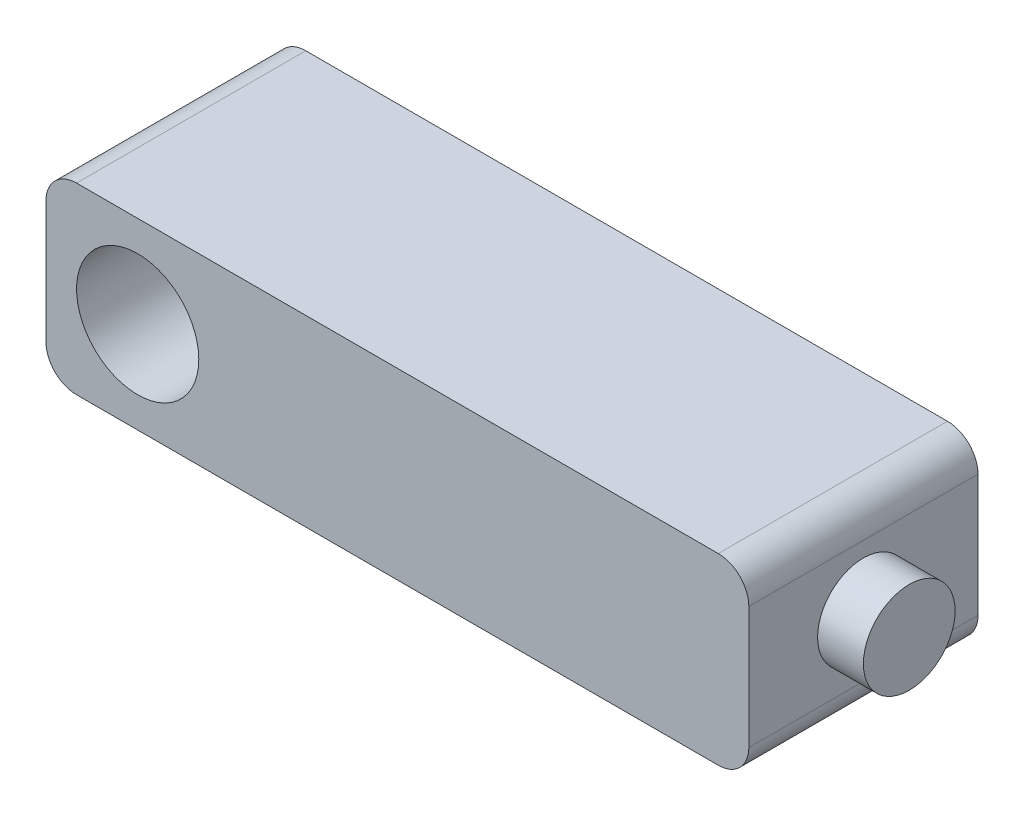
SolidWorks part; units mm, degrees
ref_plane "正面" through (0, 0, 0) normal (0, 0, 1) x (1, 0, 0)
ref_plane "平面" through (0, 0, 0) normal (0, 1, 0) x (1, 0, 0)
ref_plane "右側面" through (0, 0, 0) normal (1, 0, 0) x (0, 0, -1)
sketch "ｽｹｯﾁ1" plane through (0, 0, 0) normal (0, 0, 1) x (1, 0, 0)
  line L1 (0, 0) -> (460, 0)
  line L2 (0, 0) -> (0, 120)
  line L3 (0, 120) -> (460, 120)
  line L4 (460, 0) -> (460, 120)
  dimension "D1" = 120
  dimension "D2" = 460
extrude "押し出し1" add sketch "ｽｹｯﾁ1" along normal blind 150
sketch "ｽｹｯﾁ2" plane through (0, 0, 150) normal (0, 0, 1) x (1, 0, 0)
  line L0 (0, 120) -> (0, 0) construction
  line L2 (0, 0) -> (460, 0) construction
  circle A0 centre (60, 60) radius 40
  dimension "D1" = 80
  dimension "D2" = 60
  dimension "D3" = 60
extrude "押し出し2" cut sketch "ｽｹｯﾁ2" against normal through all
sketch "ｽｹｯﾁ3" plane through (460, 0, 0) normal (1, 0, 0) x (0, 0, -1)
  line L0 (-150, 0) -> (0, 0) construction
  line L1 (0, 0) -> (0, 120) construction
  circle A0 centre (-75, 60) radius 30
  dimension "D1" = 60
  dimension "D2" = 60
  dimension "D3" = 75
extrude "押し出し3" add sketch "ｽｹｯﾁ3" along normal blind 30
fillet "ﾌｨﾚｯﾄ1" radius 20 4 edges at (0, 0, 75) (0, 120, 75) (460, 0, 75) (460, 120, 75)
